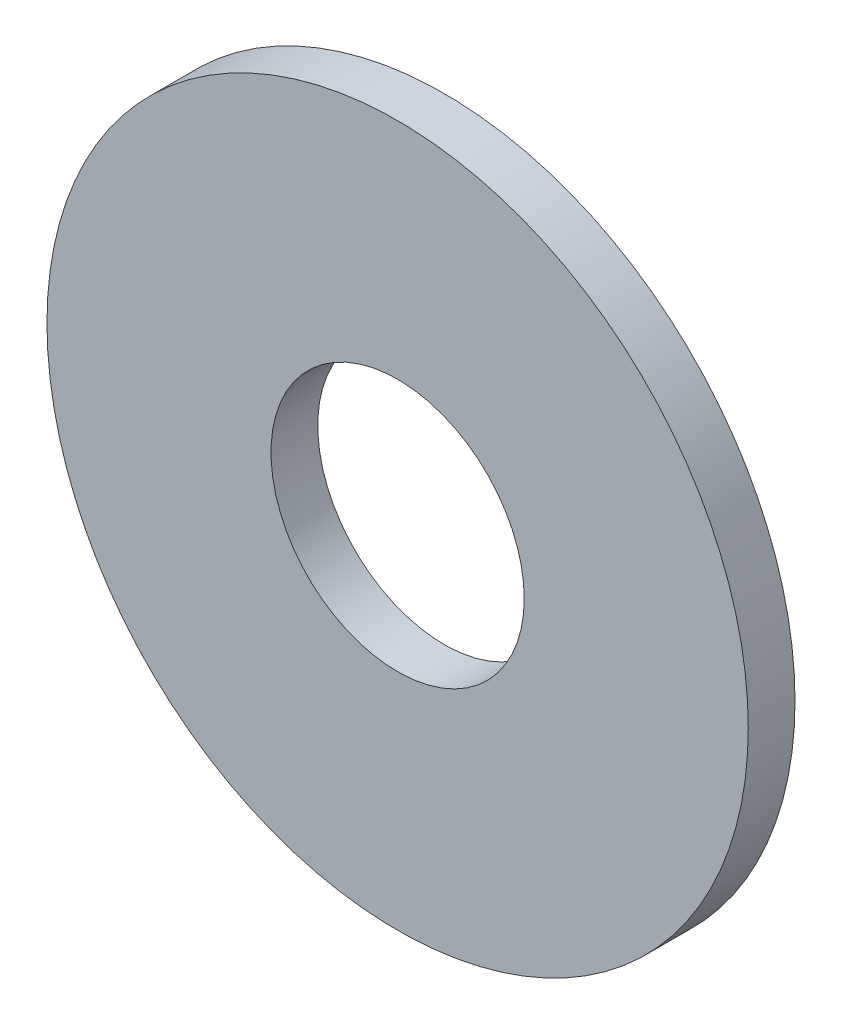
SolidWorks part; units mm, degrees
ref_plane "Plan de face" through (0, 0, 0) normal (0, 0, 1) x (1, 0, 0)
ref_plane "Plan de dessus" through (0, 0, 0) normal (0, 1, 0) x (1, 0, 0)
ref_plane "Plan de droite" through (0, 0, 0) normal (1, 0, 0) x (0, 0, -1)
sketch "Esquisse1" plane through (0, 0, 0) normal (0, 0, 1) x (1, 0, 0)
  circle A0 centre (0, 0) radius 9
  circle A1 centre (0, 0) radius 3.25
extrude "Extrusion1" add sketch "Esquisse1" along normal blind 1.2
